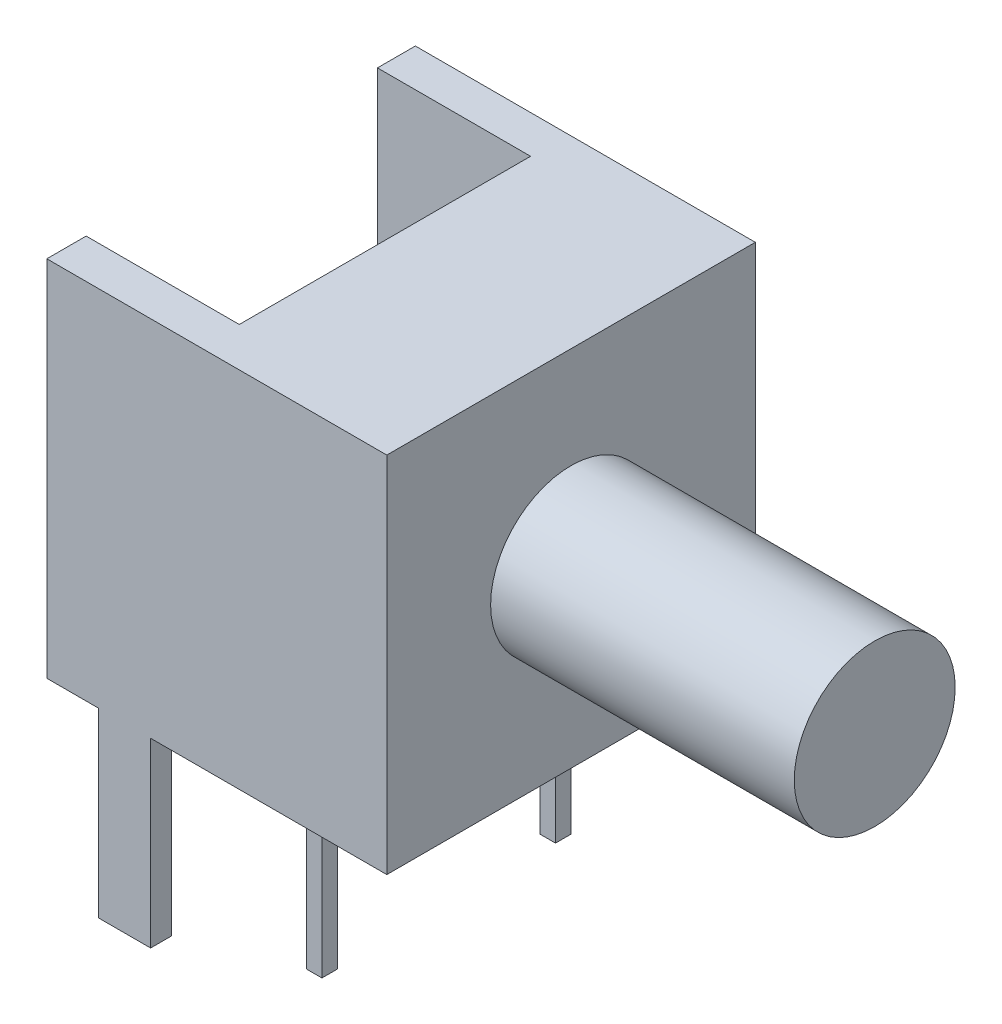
SolidWorks part; units mm, degrees
ref_plane "Front Plane" through (0, 0, 0) normal (0, 0, 1) x (1, 0, 0)
ref_plane "Top Plane" through (0, 0, 0) normal (0, 1, 0) x (1, 0, 0)
ref_plane "Right Plane" through (0, 0, 0) normal (1, 0, 0) x (0, 0, -1)
sketch "Sketch1" plane through (0, 0, 0) normal (1, 0, 0) x (0, 0, -1)
  line L1 (-3.55, -3.5) -> (3.55, -3.5)
  line L2 (-3.55, -3.5) -> (-3.55, 3.5)
  line L3 (-3.55, 3.5) -> (3.55, 3.5)
  line L4 (3.55, -3.5) -> (3.55, 3.5)
  line L5 (-3.55, -3.5) -> (3.55, 3.5) construction
  line L6 (-3.55, 3.5) -> (3.55, -3.5) construction
  point P0 (0, 0)
  dimension "D1" = 7.1
  dimension "D2" = 7
extrude "Boss-Extrude1" add sketch "Sketch1" against normal blind 6.55
sketch "Sketch2" plane through (0, -3.5, 0) normal (0, -1, 0) x (1, 0, 0)
  line L1 (-6.55, 3.55) -> (0, 3.55) construction
  line L9 (-2.7, 2.4) -> (-2.4, 2.4)
  line L10 (-5.55, 3.15) -> (-4.55, 3.15)
  line L11 (-5.55, 3.15) -> (-5.55, 3.55)
  line L12 (-5.55, 3.55) -> (-4.55, 3.55)
  line L13 (-4.55, 3.15) -> (-4.55, 3.55)
  line L14 (-5.55, 3.15) -> (-4.55, 3.55) construction
  line L15 (-5.55, 3.55) -> (-4.55, 3.15) construction
  line L16 (-2.7, 2.4) -> (-2.7, 2.1)
  line L17 (-2.7, 2.1) -> (-2.4, 2.1)
  line L18 (-2.4, 2.4) -> (-2.4, 2.1)
  line L19 (-2.7, 2.4) -> (-2.4, 2.1) construction
  line L20 (-2.7, 2.1) -> (-2.4, 2.4) construction
  point P9 (-5.05, 3.35)
  point P14 (-2.55, 2.25)
  dimension "D1" = 2.55
  dimension "D2" = 2.25
  dimension "D3" = 2.5
  dimension "D4" = 0.3
  dimension "D5" = 1
  dimension "D6" = 0.4
  dimension "D7" = 0.3
extrude "Boss-Extrude2" add sketch "Sketch2" along normal blind 3.5
mirror "Mirror1" about plane through (0, 0, 0) normal (0, 0, 1) of "Boss-Extrude2"
sketch "Sketch3" plane through (0, 3.5, 0) normal (0, 1, 0) x (1, 0, 0)
  line L0 (-6.55, 3.55) -> (-6.55, -3.55) construction
  line L1 (-6.55, 2.8201) -> (-3.6, 2.8201)
  line L2 (-6.55, 2.8201) -> (-6.55, -2.7924)
  line L3 (-6.55, -2.7924) -> (-3.6, -2.7924)
  line L4 (-3.6, 2.8201) -> (-3.6, -2.7924)
  line L5 (0, 3.55) -> (0, -3.55) construction
  dimension "D1" = 3.6
extrude "Cut-Extrude1" cut sketch "Sketch3" against normal through all
sketch "Sketch4" plane through (0, 0, 0) normal (1, 0, 0) x (0, 0, -1)
  circle A0 centre (0, 0) radius 1.55
extrude "Boss-Extrude3" add sketch "Sketch4" along normal blind 5.85
